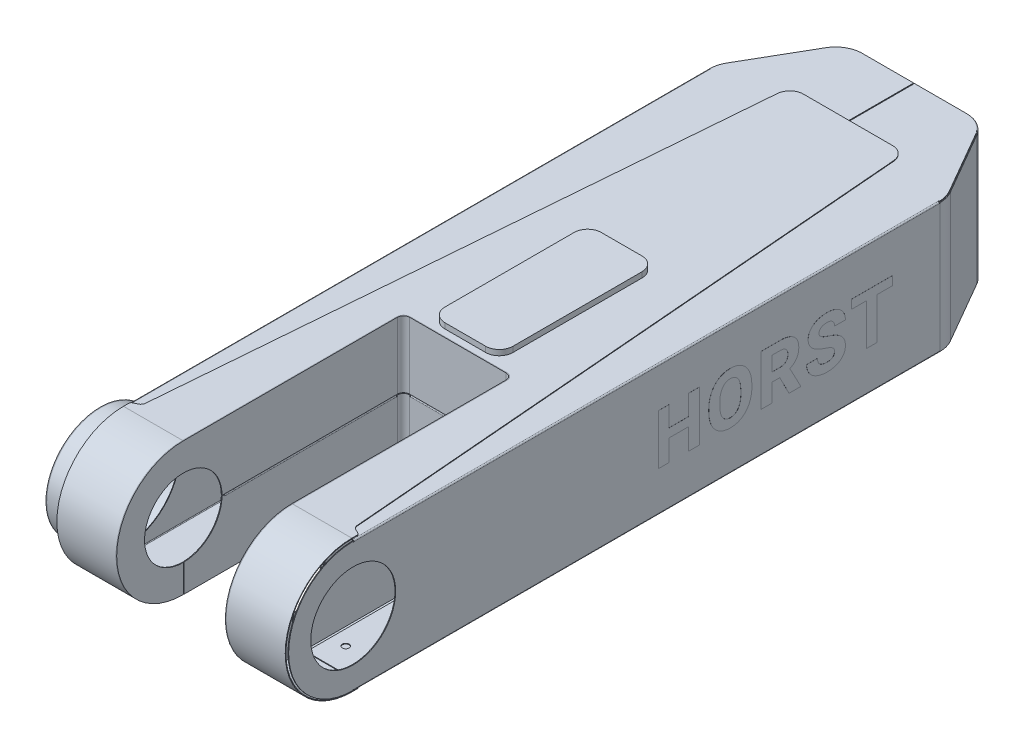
SolidWorks part; units mm, degrees
ref_plane "Ebene vorne" through (0, 0, 0) normal (0, 0, 1) x (1, 0, 0)
ref_plane "Ebene oben" through (0, 0, 0) normal (0, 1, 0) x (1, 0, 0)
ref_plane "Ebene rechts" through (0, 0, 0) normal (1, 0, 0) x (0, 0, -1)
imported_body "P001413-1/P001492-1-solid1"
imported_body "P001513-1/P001523-1-solid1"
imported_body "P001513-1/P001795-1/P001794-1-solid1"
imported_body "P001513-1/P001795-1/P001793-1-solid1"
imported_body "P001514-1/P001522-1-solid1"
imported_body "P001515-1/P001525-1-solid1"
imported_body "P001515-1/P001524-1-solid1"
imported_body "P003559-1-solid1"
imported_body "P003559-1-solid2"
imported_body "P003559-1-solid3"
imported_body "P003559-1-solid4"
imported_body "P003559-1-solid5"
imported_body "P003559-2-solid1"
imported_body "P003559-2-solid2"
imported_body "P003559-2-solid3"
imported_body "P003559-2-solid4"
imported_body "P003559-2-solid5"
imported_body "P003740-1/P001516-1-solid1"
imported_body "P003740-1/P003741-1-solid1"
other "Fläche löschen2"
other "Fläche löschen3"
other "Fläche löschen4"
